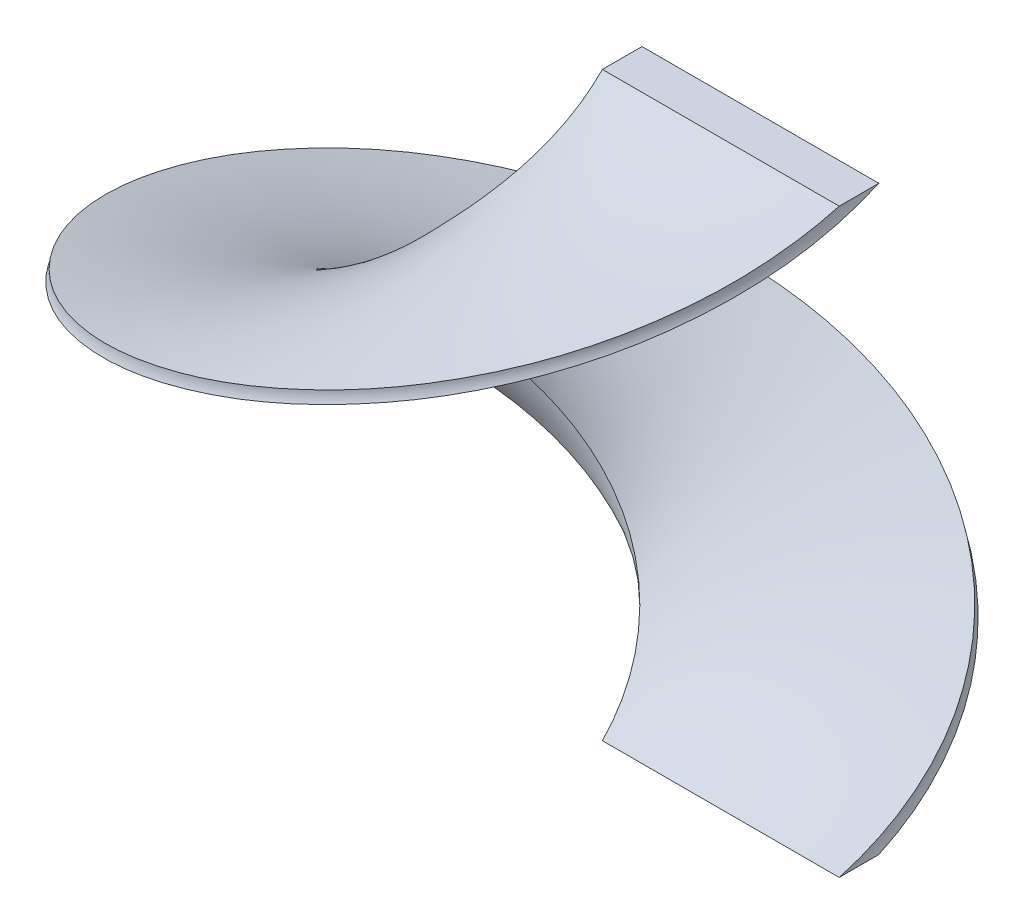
SolidWorks part; units mm, degrees
ref_plane "Front Plane" through (0, 0, 0) normal (0, 0, 1) x (1, 0, 0)
ref_plane "Top Plane" through (0, 0, 0) normal (0, 1, 0) x (1, 0, 0)
ref_plane "Right Plane" through (0, 0, 0) normal (1, 0, 0) x (0, 0, -1)
sketch "Sketch1" plane through (0, 0, 0) normal (0, 0, 1) x (1, 0, 0)
  line L0 (0, 0) -> (0, 85.725)
  dimension "D1" = 85.725
sketch "Sketch2" plane through (0, 0, 0) normal (0, 1, 0) x (1, 0, 0)
  line L1 (13.335, 5.842) -> (48.26, 5.842)
  line L2 (13.335, 5.842) -> (13.335, 0)
  line L3 (13.335, 0) -> (48.26, 0)
  line L4 (48.26, 5.842) -> (48.26, 0)
  dimension "D1" = 13.335
  dimension "D2" = 34.925
  dimension "D3" = 5.842
sweep "Sweep1" add profiles "Sketch2" path "Sketch1" parameters "D4"=360
